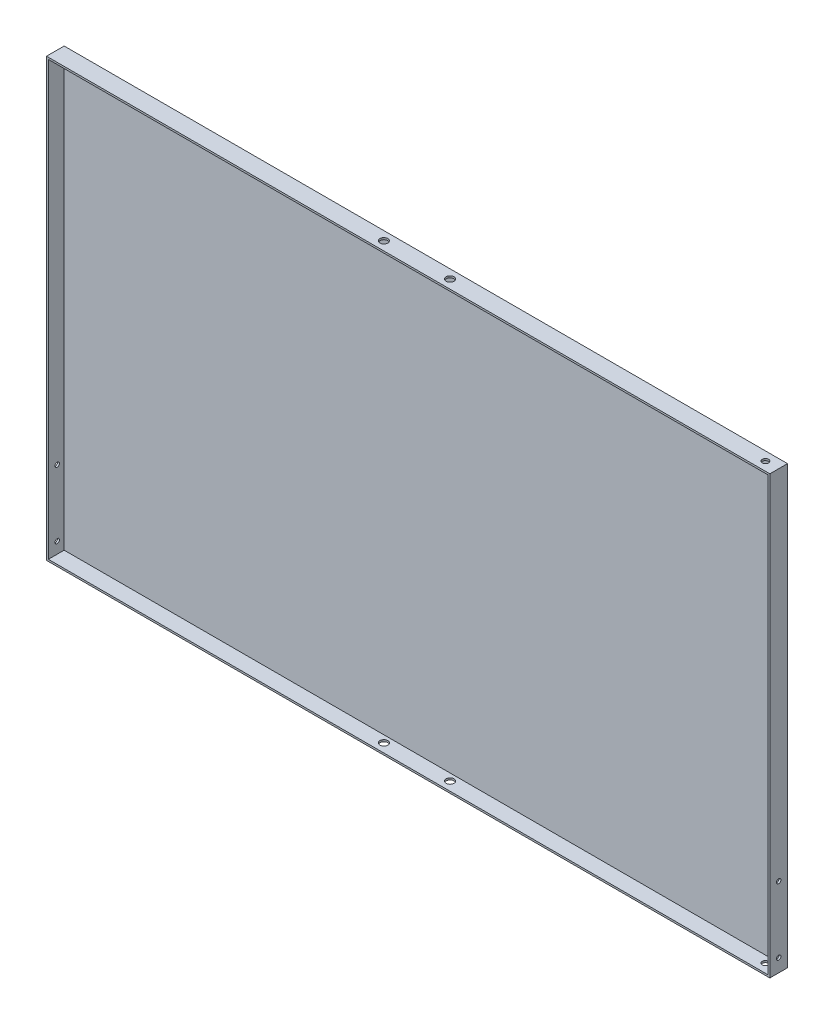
SolidWorks part; units mm, degrees
ref_plane "Plan de face" through (0, 0, 0) normal (0, 0, 1) x (1, 0, 0)
ref_plane "Plan de dessus" through (0, 0, 0) normal (0, 1, 0) x (1, 0, 0)
ref_plane "Plan de droite" through (0, 0, 0) normal (1, 0, 0) x (0, 0, -1)
sketch "Esquisse1" plane through (0, 0, 0) normal (0, 0, 1) x (1, 0, 0)
  line L1 (820, -495) -> (-820, -495)
  line L2 (820, -495) -> (820, 495)
  line L3 (820, 495) -> (-820, 495)
  line L4 (-820, -495) -> (-820, 495)
  line L5 (820, -495) -> (-820, 495) construction
  line L6 (820, 495) -> (-820, -495) construction
  point P0 (0, 0)
  dimension "D1" = 1640
  dimension "D2" = 990
extrude "Boss.-Extru.1" add sketch "Esquisse1" along normal blind 40
shell "Coque1" thickness 4.2244
sketch "Esquisse2" plane through (0, 495, 0) normal (0, 1, 0) x (1, 0, 0)
  line L0 (820, -40) -> (820, 0) construction
  line L1 (820, 0) -> (-820, 0) construction
  line L2 (0, 0) -> (0, -127.2039) construction
  circle A0 centre (790, -20) radius 7.1802
  circle A1 centre (-75, -20) radius 8.9525
  circle A2 centre (75, -20) radius 8.9525
  dimension "D1" = 30
  dimension "D2" = 20
  dimension "D3" = 150
  dimension "D4" = 20
extrude "Enlèv. mat.-Extru.1" cut sketch "Esquisse2" against normal through all
sketch "Esquisse3" plane through (-820, 0, 0) normal (-1, 0, 0) x (0, 0, 1)
  line L0 (40, -495) -> (0, -495) construction
  line L1 (0, 495) -> (0, -495) construction
  circle A0 centre (20, -465) radius 5
  circle A1 centre (20, -315) radius 5
  dimension "D2" = 10
  dimension "D3" = 150
  dimension "D4" = 30
  dimension "D5" = 20
  dimension "D1" = 2
extrude "Enlèv. mat.-Extru.2" cut sketch "Esquisse3" against normal through all both and the other way through all
